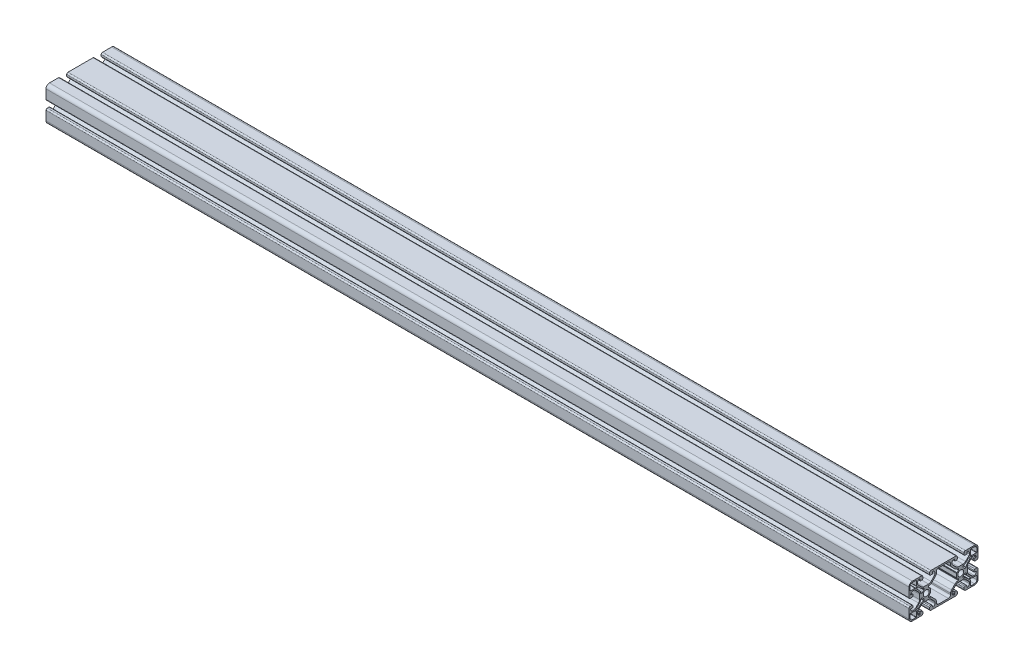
SolidWorks part; units mm, degrees
ref_plane "Ebene vorne" through (0, 0, 0) normal (0, 0, 1) x (1, 0, 0)
ref_plane "Ebene oben" through (0, 0, 0) normal (0, 1, 0) x (1, 0, 0)
ref_plane "Ebene rechts" through (0, 0, 0) normal (1, 0, 0) x (0, 0, -1)
sketch "Skizze1" plane through (0, 0, 0) normal (0, 1, 0) x (1, 0, 0)
  line L0 (0, 0) -> (1000, 0)
  dimension "D1" = 1000
other "Strukturbauteil1"
ref_plane "Ebene1" through (0, 0, 0) normal (1, 0, 0) x (0, 0, -1)
sketch "Model" plane through (0, 0, 0) normal (1, 0, 0) x (0, 0, -1)
  line L0 (-30.748, 9.3338) -> (-27.9316, 6.5174)
  line L1 (-26.0509, 2.5) -> (-24.5, 2.5)
  line L2 (-22.5, 4.5) -> (-22.5, 6.0509)
  line L3 (-26.5174, 7.9316) -> (-29.3338, 10.748)
  line L4 (-29.7581, 10.748) -> (-30.748, 9.7581)
  line L5 (-31.4, 12.9385) -> (-31.4, 18.3)
  line L6 (-31.7, 18.6) -> (-36, 18.6)
  line L7 (-38.6, 16) -> (-38.6, 11.7)
  line L8 (-38.3, 11.4) -> (-32.9385, 11.4)
  line L9 (-32.7263, 11.3121) -> (-32.1622, 10.748)
  line L10 (-31.738, 10.748) -> (-30.748, 11.738)
  line L11 (-30.748, 12.1622) -> (-31.3121, 12.7263)
  line L12 (-8.2, -15.7) -> (-8.2, -14.2225)
  line L13 (-9.313, -11.5355) -> (-13.1997, -7.6488)
  line L14 (-17.5, -5.6508) -> (-17.5, -4.5)
  line L15 (-15.5, -2.5) -> (-15.3, -2.5)
  line L16 (-15, -2.2) -> (-15, 2.2)
  line L17 (-15.3, 2.5) -> (-15.5, 2.5)
  line L18 (-17.5, 4.5) -> (-17.5, 5.6508)
  line L19 (-13.1997, 7.6488) -> (-9.313, 11.5355)
  line L20 (-8.2, 14.2225) -> (-8.2, 15.7)
  line L21 (-5.7, 18.2) -> (5.7, 18.2)
  line L22 (8.2, 15.7) -> (8.2, 14.2225)
  line L23 (9.313, 11.5355) -> (13.1997, 7.6488)
  line L24 (17.5, 5.6508) -> (17.5, 4.5)
  line L25 (15.5, 2.5) -> (15.3, 2.5)
  line L26 (15, 2.2) -> (15, -2.2)
  line L27 (15.3, -2.5) -> (15.5, -2.5)
  line L28 (17.5, -4.5) -> (17.5, -5.6508)
  line L29 (13.1997, -7.6488) -> (9.313, -11.5355)
  line L30 (8.2, -14.2225) -> (8.2, -15.7)
  line L31 (5.7, -18.2) -> (-5.7, -18.2)
  line L32 (-22.5, -6.0509) -> (-22.5, -4.5)
  line L33 (-24.5, -2.5) -> (-26.0509, -2.5)
  line L34 (-27.9316, -6.5174) -> (-30.748, -9.3338)
  line L35 (-30.748, -9.7581) -> (-29.7581, -10.748)
  line L36 (-29.3338, -10.748) -> (-26.5174, -7.9316)
  line L37 (-31.4, -12.9385) -> (-31.4, -18.3)
  line L38 (-31.7, -18.6) -> (-36, -18.6)
  line L39 (-38.6, -16) -> (-38.6, -11.7)
  line L40 (-38.3, -11.4) -> (-32.9385, -11.4)
  line L41 (-32.7263, -11.3121) -> (-32.1622, -10.748)
  line L42 (-31.738, -10.748) -> (-30.748, -11.738)
  line L43 (-30.748, -12.1622) -> (-31.3121, -12.7263)
  line L44 (-40, -16) -> (-40, -5.5)
  line L45 (-38.5, -4) -> (-36.5, -4)
  line L46 (-35.5, -5) -> (-35.5, -6.5)
  line L47 (-36, -7) -> (-37.5, -7)
  line L48 (-35.5, -10) -> (-34.2225, -10)
  line L49 (-32.8083, -9.4142) -> (-28.9216, -5.5275)
  line L50 (-27.75, -2.699) -> (-27.75, 2.699)
  line L51 (-28.9216, 5.5275) -> (-32.8083, 9.4142)
  line L52 (-34.2225, 10) -> (-35.5, 10)
  line L53 (-37.5, 7) -> (-36, 7)
  line L54 (-35.5, 6.5) -> (-35.5, 5)
  line L55 (-36.5, 4) -> (-38.5, 4)
  line L56 (-40, 5.5) -> (-40, 16)
  line L57 (-36, 20) -> (-25.5, 20)
  line L58 (-24, 18.5) -> (-24, 16.5)
  line L59 (-25, 15.5) -> (-26.5, 15.5)
  line L60 (-27, 16) -> (-27, 17.5)
  line L61 (-30, 15.5) -> (-30, 14.2225)
  line L62 (-29.4142, 12.8083) -> (-25.5275, 8.9216)
  line L63 (-22.699, 7.75) -> (-17.301, 7.75)
  line L64 (-14.4725, 8.9216) -> (-10.5858, 12.8083)
  line L65 (-10, 14.2225) -> (-10, 15.5)
  line L66 (-13, 17.5) -> (-13, 16)
  line L67 (-13.5, 15.5) -> (-15, 15.5)
  line L68 (-16, 16.5) -> (-16, 18.5)
  line L69 (-14.5, 20) -> (14.5, 20)
  line L70 (16, 18.5) -> (16, 16.5)
  line L71 (15, 15.5) -> (13.5, 15.5)
  line L72 (13, 16) -> (13, 17.5)
  line L73 (10, 15.5) -> (10, 14.2225)
  line L74 (10.5858, 12.8083) -> (14.4725, 8.9216)
  line L75 (17.301, 7.75) -> (22.699, 7.75)
  line L76 (25.5275, 8.9216) -> (29.4142, 12.8083)
  line L77 (30, 14.2225) -> (30, 15.5)
  line L78 (27, 17.5) -> (27, 16)
  line L79 (26.5, 15.5) -> (25, 15.5)
  line L80 (24, 16.5) -> (24, 18.5)
  line L81 (25.5, 20) -> (36, 20)
  line L82 (40, 16) -> (40, 5.5)
  line L83 (38.5, 4) -> (36.5, 4)
  line L84 (35.5, 5) -> (35.5, 6.5)
  line L85 (36, 7) -> (37.5, 7)
  line L86 (35.5, 10) -> (34.2225, 10)
  line L87 (32.8083, 9.4142) -> (28.9216, 5.5275)
  line L88 (27.75, 2.699) -> (27.75, -2.699)
  line L89 (28.9216, -5.5275) -> (32.8083, -9.4142)
  line L90 (34.2225, -10) -> (35.5, -10)
  line L91 (37.5, -7) -> (36, -7)
  line L92 (35.5, -6.5) -> (35.5, -5)
  line L93 (36.5, -4) -> (38.5, -4)
  line L94 (40, -5.5) -> (40, -16)
  line L95 (36, -20) -> (25.5, -20)
  line L96 (24, -18.5) -> (24, -16.5)
  line L97 (25, -15.5) -> (26.5, -15.5)
  line L98 (27, -16) -> (27, -17.5)
  line L99 (30, -15.5) -> (30, -14.2225)
  line L100 (29.4142, -12.8083) -> (25.5275, -8.9216)
  line L101 (22.699, -7.75) -> (17.301, -7.75)
  line L102 (14.4725, -8.9216) -> (10.5858, -12.8083)
  line L103 (10, -14.2225) -> (10, -15.5)
  line L104 (13, -17.5) -> (13, -16)
  line L105 (13.5, -15.5) -> (15, -15.5)
  line L106 (16, -16.5) -> (16, -18.5)
  line L107 (14.5, -20) -> (-14.5, -20)
  line L108 (-16, -18.5) -> (-16, -16.5)
  line L109 (-15, -15.5) -> (-13.5, -15.5)
  line L110 (-13, -16) -> (-13, -17.5)
  line L111 (-10, -15.5) -> (-10, -14.2225)
  line L112 (-10.5858, -12.8083) -> (-14.4725, -8.9216)
  line L113 (-17.301, -7.75) -> (-22.699, -7.75)
  line L114 (-25.5275, -8.9216) -> (-29.4142, -12.8083)
  line L115 (-30, -14.2225) -> (-30, -15.5)
  line L116 (-27, -17.5) -> (-27, -16)
  line L117 (-26.5, -15.5) -> (-25, -15.5)
  line L118 (-24, -16.5) -> (-24, -18.5)
  line L119 (-25.5, -20) -> (-36, -20)
  line L120 (32.9385, 11.4) -> (38.3, 11.4)
  line L121 (38.6, 11.7) -> (38.6, 16)
  line L122 (36, 18.6) -> (31.7, 18.6)
  line L123 (31.4, 18.3) -> (31.4, 12.9385)
  line L124 (31.3121, 12.7263) -> (30.748, 12.1622)
  line L125 (30.748, 11.738) -> (31.738, 10.748)
  line L126 (32.1622, 10.748) -> (32.7263, 11.3121)
  line L127 (22.5, 4.5) -> (22.5, 6.0509)
  line L128 (26.5174, 7.9316) -> (29.3338, 10.748)
  line L129 (29.7581, 10.748) -> (30.748, 9.7581)
  line L130 (30.748, 9.3338) -> (27.9316, 6.5174)
  line L131 (26.0509, 2.5) -> (24.5, 2.5)
  line L132 (31.4, -12.9385) -> (31.4, -18.3)
  line L133 (31.7, -18.6) -> (36, -18.6)
  line L134 (38.6, -16) -> (38.6, -11.7)
  line L135 (38.3, -11.4) -> (32.9385, -11.4)
  line L136 (32.7263, -11.3121) -> (32.1622, -10.748)
  line L137 (31.738, -10.748) -> (30.748, -11.738)
  line L138 (30.748, -12.1622) -> (31.3121, -12.7263)
  line L139 (22.5, -4.5) -> (22.5, -6.0509)
  line L140 (26.5174, -7.9316) -> (29.3338, -10.748)
  line L141 (29.7581, -10.748) -> (30.748, -9.7581)
  line L142 (30.748, -9.3338) -> (27.9316, -6.5174)
  line L143 (26.0509, -2.5) -> (24.5, -2.5)
  line L144 (-22.6415, -4.2453) -> (-23.5355, -3.5355)
  line L145 (-40, -20) -> (40, -20) construction
  line L146 (-40, -20) -> (-40, 20) construction
  line L147 (-40, 20) -> (40, 20) construction
  line L148 (40, -20) -> (40, 20) construction
  line L149 (-40, -20) -> (40, 20) construction
  line L150 (-40, 20) -> (40, -20) construction
  line L151 (-22.6815, -6.3265) -> (-22.586, -6.2611)
  line L152 (-22.5, -6.0509) -> (-22.5223, -6.1645)
  line L153 (-22.5223, -6.1645) -> (-22.586, -6.2611)
  line L154 (-22.7947, -6.3508) -> (-22.6815, -6.3265)
  line L155 (-23.5355, -3.5355) -> (-24.2453, -2.6415)
  line L156 (-17.3585, 4.2453) -> (-16.4645, 3.5355)
  line L157 (-26.0509, -2.5) -> (-26.1645, -2.5223)
  line L158 (-26.1645, -2.5223) -> (-26.2611, -2.586)
  line L159 (-26.3265, -2.6815) -> (-26.2611, -2.586)
  line L160 (-26.3508, -2.7947) -> (-26.3265, -2.6815)
  line L161 (-26.3508, 2.7947) -> (-26.3265, 2.6815)
  line L162 (-26.3265, 2.6815) -> (-26.2611, 2.586)
  line L163 (-26.1645, 2.5223) -> (-26.2611, 2.586)
  line L164 (-26.0509, 2.5) -> (-26.1645, 2.5223)
  line L165 (-23.5355, 3.5355) -> (-24.2453, 2.6415)
  line L166 (-22.6415, 4.2453) -> (-23.5355, 3.5355)
  line L167 (-22.5, 6.0509) -> (-22.5223, 6.1645)
  line L168 (-22.5223, 6.1645) -> (-22.586, 6.2611)
  line L169 (-22.6815, 6.3265) -> (-22.586, 6.2611)
  line L170 (-22.7947, 6.3508) -> (-22.6815, 6.3265)
  line L171 (-16.4645, 3.5355) -> (-15.7547, 2.6415)
  line L172 (-15.7547, -2.6415) -> (-16.4645, -3.5355)
  line L173 (-16.4645, -3.5355) -> (-17.3585, -4.2453)
  line L174 (-17.4776, 5.7645) -> (-17.4139, 5.8612)
  line L175 (-27.3087, -17.9619) -> (-27.1464, -17.8536)
  line L176 (-17.205, 5.9508) -> (-17.3182, 5.9266)
  line L177 (-17.3182, 5.9266) -> (-17.4139, 5.8612)
  line L178 (-17.5, 5.6508) -> (-17.4776, 5.7645)
  line L179 (-17.5, -5.6508) -> (-17.4776, -5.7645)
  line L180 (-17.4776, -5.7645) -> (-17.4139, -5.8612)
  line L181 (-17.3182, -5.9266) -> (-17.4139, -5.8612)
  line L182 (-17.205, -5.9508) -> (-17.3182, -5.9266)
  line L184 (-27, -17.5) -> (-27.0381, -17.6913)
  line L185 (-27.0381, -17.6913) -> (-27.1464, -17.8536)
  line L186 (-27.5, -18) -> (-27.3087, -17.9619)
  line L187 (-12.5, -18) -> (-12.6913, -17.9619)
  line L188 (-12.6913, -17.9619) -> (-12.8536, -17.8536)
  line L189 (-12.9619, -17.6913) -> (-12.8536, -17.8536)
  line L190 (-13, -17.5) -> (-12.9619, -17.6913)
  line L191 (22.7947, 6.3508) -> (22.6815, 6.3265)
  line L192 (-27.5, 18) -> (-27.3087, 17.9619)
  line L193 (-27.3087, 17.9619) -> (-27.1464, 17.8536)
  line L194 (-27.0381, 17.6913) -> (-27.1464, 17.8536)
  line L195 (-27, 17.5) -> (-27.0381, 17.6913)
  line L196 (-13, 17.5) -> (-12.9619, 17.6913)
  line L197 (-12.9619, 17.6913) -> (-12.8536, 17.8536)
  line L198 (-12.6913, 17.9619) -> (-12.8536, 17.8536)
  line L199 (-12.5, 18) -> (-12.6913, 17.9619)
  line L200 (12.5, -18) -> (12.6913, -17.9619)
  line L201 (12.6913, -17.9619) -> (12.8536, -17.8536)
  line L202 (12.9619, -17.6913) -> (12.8536, -17.8536)
  line L203 (13, -17.5) -> (12.9619, -17.6913)
  line L204 (27, -17.5) -> (27.0381, -17.6913)
  line L205 (27.0381, -17.6913) -> (27.1464, -17.8536)
  line L206 (27.3087, -17.9619) -> (27.1464, -17.8536)
  line L207 (27.5, -18) -> (27.3087, -17.9619)
  line L208 (27, 17.5) -> (27.0381, 17.6913)
  line L209 (27.0381, 17.6913) -> (27.1464, 17.8536)
  line L210 (27.3087, 17.9619) -> (27.1464, 17.8536)
  line L211 (27.5, 18) -> (27.3087, 17.9619)
  line L212 (13, 17.5) -> (12.9619, 17.6913)
  line L213 (12.9619, 17.6913) -> (12.8536, 17.8536)
  line L214 (12.6913, 17.9619) -> (12.8536, 17.8536)
  line L215 (12.5, 18) -> (12.6913, 17.9619)
  line L216 (22.6815, 6.3265) -> (22.586, 6.2611)
  line L217 (22.5223, 6.1645) -> (22.586, 6.2611)
  line L218 (22.5, 6.0509) -> (22.5223, 6.1645)
  line L219 (22.6415, 4.2453) -> (23.5355, 3.5355)
  line L220 (23.5355, 3.5355) -> (24.2453, 2.6415)
  line L221 (26.0509, 2.5) -> (26.1645, 2.5223)
  line L222 (26.1645, 2.5223) -> (26.2611, 2.586)
  line L223 (26.3265, 2.6815) -> (26.2611, 2.586)
  line L224 (26.3508, 2.7947) -> (26.3265, 2.6815)
  line L225 (26.3508, -2.7947) -> (26.3265, -2.6815)
  line L226 (26.3265, -2.6815) -> (26.2611, -2.586)
  line L227 (26.1645, -2.5223) -> (26.2611, -2.586)
  line L228 (26.0509, -2.5) -> (26.1645, -2.5223)
  line L229 (23.5355, -3.5355) -> (24.2453, -2.6415)
  line L230 (22.6415, -4.2453) -> (23.5355, -3.5355)
  line L231 (22.5, -6.0509) -> (22.5223, -6.1645)
  line L232 (22.5223, -6.1645) -> (22.586, -6.2611)
  line L233 (22.6815, -6.3265) -> (22.586, -6.2611)
  line L234 (22.7947, -6.3508) -> (22.6815, -6.3265)
  line L235 (17.5, 5.6508) -> (17.4776, 5.7645)
  line L236 (17.4776, 5.7645) -> (17.4139, 5.8612)
  line L237 (17.3182, 5.9266) -> (17.4139, 5.8612)
  line L238 (17.205, 5.9508) -> (17.3182, 5.9266)
  line L239 (17.5, -5.6508) -> (17.4776, -5.7645)
  line L240 (17.4776, -5.7645) -> (17.4139, -5.8612)
  line L241 (17.3182, -5.9266) -> (17.4139, -5.8612)
  line L242 (17.205, -5.9508) -> (17.3182, -5.9266)
  line L244 (-38, -7.5) -> (-37.9619, -7.3087)
  line L245 (-37.9619, -7.3087) -> (-37.8536, -7.1464)
  line L246 (-37.6913, -7.0381) -> (-37.8536, -7.1464)
  line L247 (-37.5, -7) -> (-37.6913, -7.0381)
  line L248 (-37.5, 7) -> (-37.6913, 7.0381)
  line L249 (-37.6913, 7.0381) -> (-37.8536, 7.1464)
  line L250 (-37.9619, 7.3087) -> (-37.8536, 7.1464)
  line L251 (-38, 7.5) -> (-37.9619, 7.3087)
  line L252 (37.5, -7) -> (37.6913, -7.0381)
  line L253 (37.6913, -7.0381) -> (37.8536, -7.1464)
  line L254 (37.9619, -7.3087) -> (37.8536, -7.1464)
  line L255 (38, -7.5) -> (37.9619, -7.3087)
  line L256 (37.5, 7) -> (37.6913, 7.0381)
  line L257 (37.6913, 7.0381) -> (37.8536, 7.1464)
  line L258 (37.9619, 7.3087) -> (37.8536, 7.1464)
  line L259 (38, 7.5) -> (37.9619, 7.3087)
  circle A0 centre (-20, 0) radius 3.4
  circle A1 centre (20, 0) radius 3.4
  arc A2 (-26.3508, 2.7947) -> (-27.9316, 6.5174) centre (-31.75, 2.699) ccw
  arc A4 (-24.5, 2.5) -> (-24.2453, 2.6415) centre (-24.5, 2.8) ccw
  arc A6 (-22.6415, 4.2453) -> (-22.5, 4.5) centre (-22.8, 4.5) ccw
  arc A8 (-26.5174, 7.9316) -> (-22.7947, 6.3508) centre (-22.699, 11.75) ccw
  arc A9 (-29.3338, 10.748) -> (-29.7581, 10.748) centre (-29.5459, 10.5359) ccw
  arc A10 (-30.748, 9.7581) -> (-30.748, 9.3338) centre (-30.5359, 9.5459) ccw
  arc A11 (-31.4, 12.9385) -> (-31.3121, 12.7263) centre (-31.1, 12.9385) ccw
  arc A12 (-31.4, 18.3) -> (-31.7, 18.6) centre (-31.7, 18.3) ccw
  arc A13 (-36, 18.6) -> (-38.6, 16) centre (-36, 16) ccw
  arc A14 (-38.6, 11.7) -> (-38.3, 11.4) centre (-38.3, 11.7) ccw
  arc A15 (-32.7263, 11.3121) -> (-32.9385, 11.4) centre (-32.9385, 11.1) ccw
  arc A16 (-32.1622, 10.748) -> (-31.738, 10.748) centre (-31.9501, 10.9602) ccw
  arc A17 (-30.748, 11.738) -> (-30.748, 12.1622) centre (-30.9602, 11.9501) ccw
  arc A18 (-8.2, -15.7) -> (-5.7, -18.2) centre (-5.7, -15.7) ccw
  arc A19 (-8.2, -14.2225) -> (-9.313, -11.5355) centre (-12, -14.2225) ccw
  arc A20 (-13.1997, -7.6488) -> (-17.205, -5.9508) centre (-17.301, -11.75) ccw
  arc A22 (-17.3585, -4.2453) -> (-17.5, -4.5) centre (-17.2, -4.5) ccw
  arc A24 (-15.5, -2.5) -> (-15.7547, -2.6415) centre (-15.5, -2.8) ccw
  arc A25 (-15.3, -2.5) -> (-15, -2.2) centre (-15.3, -2.2) ccw
  arc A26 (-15, 2.2) -> (-15.3, 2.5) centre (-15.3, 2.2) ccw
  arc A27 (-15.7547, 2.6415) -> (-15.5, 2.5) centre (-15.5, 2.8) ccw
  arc A29 (-17.5, 4.5) -> (-17.3585, 4.2453) centre (-17.2, 4.5) ccw
  arc A31 (-17.205, 5.9508) -> (-13.1997, 7.6488) centre (-17.301, 11.75) ccw
  arc A32 (-9.313, 11.5355) -> (-8.2, 14.2225) centre (-12, 14.2225) ccw
  arc A33 (-5.7, 18.2) -> (-8.2, 15.7) centre (-5.7, 15.7) ccw
  arc A34 (8.2, 15.7) -> (5.7, 18.2) centre (5.7, 15.7) ccw
  arc A35 (8.2, 14.2225) -> (9.313, 11.5355) centre (12, 14.2225) ccw
  arc A36 (13.1997, 7.6488) -> (17.205, 5.9508) centre (17.301, 11.75) ccw
  arc A38 (17.3585, 4.2453) -> (17.5, 4.5) centre (17.2, 4.5) ccw
  arc A39 (17.3585, 4.2453) -> (15.7547, 2.6415) centre (20, 0) ccw
  arc A40 (15.5, 2.5) -> (15.7547, 2.6415) centre (15.5, 2.8) ccw
  arc A41 (15.3, 2.5) -> (15, 2.2) centre (15.3, 2.2) ccw
  arc A42 (15, -2.2) -> (15.3, -2.5) centre (15.3, -2.2) ccw
  arc A43 (15.7547, -2.6415) -> (15.5, -2.5) centre (15.5, -2.8) ccw
  arc A44 (15.7547, -2.6415) -> (17.3585, -4.2453) centre (20, 0) ccw
  arc A45 (17.5, -4.5) -> (17.3585, -4.2453) centre (17.2, -4.5) ccw
  arc A47 (17.205, -5.9508) -> (13.1997, -7.6488) centre (17.301, -11.75) ccw
  arc A48 (9.313, -11.5355) -> (8.2, -14.2225) centre (12, -14.2225) ccw
  arc A49 (5.7, -18.2) -> (8.2, -15.7) centre (5.7, -15.7) ccw
  arc A51 (-22.5, -4.5) -> (-22.6415, -4.2453) centre (-22.8, -4.5) ccw
  arc A53 (-24.2453, -2.6415) -> (-24.5, -2.5) centre (-24.5, -2.8) ccw
  arc A55 (-27.9316, -6.5174) -> (-26.3508, -2.7947) centre (-31.75, -2.699) ccw
  arc A56 (-30.748, -9.3338) -> (-30.748, -9.7581) centre (-30.5359, -9.5459) ccw
  arc A57 (-29.7581, -10.748) -> (-29.3338, -10.748) centre (-29.5459, -10.5359) ccw
  arc A58 (-22.7947, -6.3508) -> (-26.5174, -7.9316) centre (-22.699, -11.75) ccw
  arc A59 (-31.3121, -12.7263) -> (-31.4, -12.9385) centre (-31.1, -12.9385) ccw
  arc A60 (-31.7, -18.6) -> (-31.4, -18.3) centre (-31.7, -18.3) ccw
  arc A61 (-38.6, -16) -> (-36, -18.6) centre (-36, -16) ccw
  arc A62 (-38.3, -11.4) -> (-38.6, -11.7) centre (-38.3, -11.7) ccw
  arc A63 (-32.9385, -11.4) -> (-32.7263, -11.3121) centre (-32.9385, -11.1) ccw
  arc A64 (-31.738, -10.748) -> (-32.1622, -10.748) centre (-31.9501, -10.9602) ccw
  arc A65 (-30.748, -12.1622) -> (-30.748, -11.738) centre (-30.9602, -11.9501) ccw
  arc A66 (-38.5, -4) -> (-40, -5.5) centre (-38.5, -5.5) ccw
  arc A67 (-35.5, -5) -> (-36.5, -4) centre (-36.5, -5) ccw
  arc A68 (-36, -7) -> (-35.5, -6.5) centre (-36, -6.5) ccw
  arc A70 (-38, -7.5) -> (-35.5, -10) centre (-35.5, -7.5) ccw
  arc A71 (-34.2225, -10) -> (-32.8083, -9.4142) centre (-34.2225, -8) ccw
  arc A72 (-28.9216, -5.5275) -> (-27.75, -2.699) centre (-31.75, -2.699) ccw
  arc A73 (-27.75, 2.699) -> (-28.9216, 5.5275) centre (-31.75, 2.699) ccw
  arc A74 (-32.8083, 9.4142) -> (-34.2225, 10) centre (-34.2225, 8) ccw
  arc A75 (-35.5, 10) -> (-38, 7.5) centre (-35.5, 7.5) ccw
  arc A77 (-35.5, 6.5) -> (-36, 7) centre (-36, 6.5) ccw
  arc A78 (-36.5, 4) -> (-35.5, 5) centre (-36.5, 5) ccw
  arc A79 (-40, 5.5) -> (-38.5, 4) centre (-38.5, 5.5) ccw
  arc A80 (-36, 20) -> (-40, 16) centre (-36, 16) ccw
  arc A81 (-24, 18.5) -> (-25.5, 20) centre (-25.5, 18.5) ccw
  arc A82 (-25, 15.5) -> (-24, 16.5) centre (-25, 16.5) ccw
  arc A83 (-27, 16) -> (-26.5, 15.5) centre (-26.5, 16) ccw
  arc A85 (-27.5, 18) -> (-30, 15.5) centre (-27.5, 15.5) ccw
  arc A86 (-30, 14.2225) -> (-29.4142, 12.8083) centre (-28, 14.2225) ccw
  arc A87 (-25.5275, 8.9216) -> (-22.699, 7.75) centre (-22.699, 11.75) ccw
  arc A88 (-17.301, 7.75) -> (-14.4725, 8.9216) centre (-17.301, 11.75) ccw
  arc A89 (-10.5858, 12.8083) -> (-10, 14.2225) centre (-12, 14.2225) ccw
  arc A90 (-10, 15.5) -> (-12.5, 18) centre (-12.5, 15.5) ccw
  arc A92 (-13.5, 15.5) -> (-13, 16) centre (-13.5, 16) ccw
  arc A93 (-16, 16.5) -> (-15, 15.5) centre (-15, 16.5) ccw
  arc A94 (-14.5, 20) -> (-16, 18.5) centre (-14.5, 18.5) ccw
  arc A95 (16, 18.5) -> (14.5, 20) centre (14.5, 18.5) ccw
  arc A96 (15, 15.5) -> (16, 16.5) centre (15, 16.5) ccw
  arc A97 (13, 16) -> (13.5, 15.5) centre (13.5, 16) ccw
  arc A99 (12.5, 18) -> (10, 15.5) centre (12.5, 15.5) ccw
  arc A100 (10, 14.2225) -> (10.5858, 12.8083) centre (12, 14.2225) ccw
  arc A101 (14.4725, 8.9216) -> (17.301, 7.75) centre (17.301, 11.75) ccw
  arc A102 (22.699, 7.75) -> (25.5275, 8.9216) centre (22.699, 11.75) ccw
  arc A103 (29.4142, 12.8083) -> (30, 14.2225) centre (28, 14.2225) ccw
  arc A104 (30, 15.5) -> (27.5, 18) centre (27.5, 15.5) ccw
  arc A106 (26.5, 15.5) -> (27, 16) centre (26.5, 16) ccw
  arc A107 (24, 16.5) -> (25, 15.5) centre (25, 16.5) ccw
  arc A108 (25.5, 20) -> (24, 18.5) centre (25.5, 18.5) ccw
  arc A109 (40, 16) -> (36, 20) centre (36, 16) ccw
  arc A110 (38.5, 4) -> (40, 5.5) centre (38.5, 5.5) ccw
  arc A111 (35.5, 5) -> (36.5, 4) centre (36.5, 5) ccw
  arc A112 (36, 7) -> (35.5, 6.5) centre (36, 6.5) ccw
  arc A114 (38, 7.5) -> (35.5, 10) centre (35.5, 7.5) ccw
  arc A115 (34.2225, 10) -> (32.8083, 9.4142) centre (34.2225, 8) ccw
  arc A116 (28.9216, 5.5275) -> (27.75, 2.699) centre (31.75, 2.699) ccw
  arc A117 (27.75, -2.699) -> (28.9216, -5.5275) centre (31.75, -2.699) ccw
  arc A118 (32.8083, -9.4142) -> (34.2225, -10) centre (34.2225, -8) ccw
  arc A119 (35.5, -10) -> (38, -7.5) centre (35.5, -7.5) ccw
  arc A121 (35.5, -6.5) -> (36, -7) centre (36, -6.5) ccw
  arc A122 (36.5, -4) -> (35.5, -5) centre (36.5, -5) ccw
  arc A123 (40, -5.5) -> (38.5, -4) centre (38.5, -5.5) ccw
  arc A124 (36, -20) -> (40, -16) centre (36, -16) ccw
  arc A125 (24, -18.5) -> (25.5, -20) centre (25.5, -18.5) ccw
  arc A126 (25, -15.5) -> (24, -16.5) centre (25, -16.5) ccw
  arc A127 (27, -16) -> (26.5, -15.5) centre (26.5, -16) ccw
  arc A129 (27.5, -18) -> (30, -15.5) centre (27.5, -15.5) ccw
  arc A130 (30, -14.2225) -> (29.4142, -12.8083) centre (28, -14.2225) ccw
  arc A131 (25.5275, -8.9216) -> (22.699, -7.75) centre (22.699, -11.75) ccw
  arc A132 (17.301, -7.75) -> (14.4725, -8.9216) centre (17.301, -11.75) ccw
  arc A133 (10.5858, -12.8083) -> (10, -14.2225) centre (12, -14.2225) ccw
  arc A134 (10, -15.5) -> (12.5, -18) centre (12.5, -15.5) ccw
  arc A136 (13.5, -15.5) -> (13, -16) centre (13.5, -16) ccw
  arc A137 (16, -16.5) -> (15, -15.5) centre (15, -16.5) ccw
  arc A138 (14.5, -20) -> (16, -18.5) centre (14.5, -18.5) ccw
  arc A139 (-16, -18.5) -> (-14.5, -20) centre (-14.5, -18.5) ccw
  arc A140 (-15, -15.5) -> (-16, -16.5) centre (-15, -16.5) ccw
  arc A141 (-13, -16) -> (-13.5, -15.5) centre (-13.5, -16) ccw
  arc A143 (-12.5, -18) -> (-10, -15.5) centre (-12.5, -15.5) ccw
  arc A144 (-10, -14.2225) -> (-10.5858, -12.8083) centre (-12, -14.2225) ccw
  arc A145 (-14.4725, -8.9216) -> (-17.301, -7.75) centre (-17.301, -11.75) ccw
  arc A146 (-22.699, -7.75) -> (-25.5275, -8.9216) centre (-22.699, -11.75) ccw
  arc A147 (-29.4142, -12.8083) -> (-30, -14.2225) centre (-28, -14.2225) ccw
  arc A148 (-30, -15.5) -> (-27.5, -18) centre (-27.5, -15.5) ccw
  arc A150 (-26.5, -15.5) -> (-27, -16) centre (-26.5, -16) ccw
  arc A151 (-24, -16.5) -> (-25, -15.5) centre (-25, -16.5) ccw
  arc A152 (-25.5, -20) -> (-24, -18.5) centre (-25.5, -18.5) ccw
  arc A153 (-40, -16) -> (-36, -20) centre (-36, -16) ccw
  arc A154 (32.9385, 11.4) -> (32.7263, 11.3121) centre (32.9385, 11.1) ccw
  arc A155 (38.3, 11.4) -> (38.6, 11.7) centre (38.3, 11.7) ccw
  arc A156 (38.6, 16) -> (36, 18.6) centre (36, 16) ccw
  arc A157 (31.7, 18.6) -> (31.4, 18.3) centre (31.7, 18.3) ccw
  arc A158 (31.3121, 12.7263) -> (31.4, 12.9385) centre (31.1, 12.9385) ccw
  arc A159 (30.748, 12.1622) -> (30.748, 11.738) centre (30.9602, 11.9501) ccw
  arc A160 (31.738, 10.748) -> (32.1622, 10.748) centre (31.9501, 10.9602) ccw
  arc A161 (22.5, 4.5) -> (22.6415, 4.2453) centre (22.8, 4.5) ccw
  arc A163 (22.7947, 6.3508) -> (26.5174, 7.9316) centre (22.699, 11.75) ccw
  arc A164 (29.7581, 10.748) -> (29.3338, 10.748) centre (29.5459, 10.5359) ccw
  arc A165 (30.748, 9.3338) -> (30.748, 9.7581) centre (30.5359, 9.5459) ccw
  arc A166 (27.9316, 6.5174) -> (26.3508, 2.7947) centre (31.75, 2.699) ccw
  arc A168 (24.2453, 2.6415) -> (24.5, 2.5) centre (24.5, 2.8) ccw
  arc A170 (31.4, -12.9385) -> (31.3121, -12.7263) centre (31.1, -12.9385) ccw
  arc A171 (31.4, -18.3) -> (31.7, -18.6) centre (31.7, -18.3) ccw
  arc A172 (36, -18.6) -> (38.6, -16) centre (36, -16) ccw
  arc A173 (38.6, -11.7) -> (38.3, -11.4) centre (38.3, -11.7) ccw
  arc A174 (32.7263, -11.3121) -> (32.9385, -11.4) centre (32.9385, -11.1) ccw
  arc A175 (32.1622, -10.748) -> (31.738, -10.748) centre (31.9501, -10.9602) ccw
  arc A176 (30.748, -11.738) -> (30.748, -12.1622) centre (30.9602, -11.9501) ccw
  arc A177 (22.6415, -4.2453) -> (22.5, -4.5) centre (22.8, -4.5) ccw
  arc A179 (26.5174, -7.9316) -> (22.7947, -6.3508) centre (22.699, -11.75) ccw
  arc A180 (29.3338, -10.748) -> (29.7581, -10.748) centre (29.5459, -10.5359) ccw
  arc A181 (30.748, -9.7581) -> (30.748, -9.3338) centre (30.5359, -9.5459) ccw
  arc A182 (26.3508, -2.7947) -> (27.9316, -6.5174) centre (31.75, -2.699) ccw
  arc A184 (24.5, -2.5) -> (24.2453, -2.6415) centre (24.5, -2.8) ccw
  point P219 (0, 0)
  point P488 (0, 0)
  point P494 (-40, 0)
  point P495 (-20, -20)
  point P496 (-20, 20)
  point P497 (0, 20)
  point P498 (0, -20)
  point P499 (20, -20)
  point P500 (40, 0)
  point P501 (20, 20)
